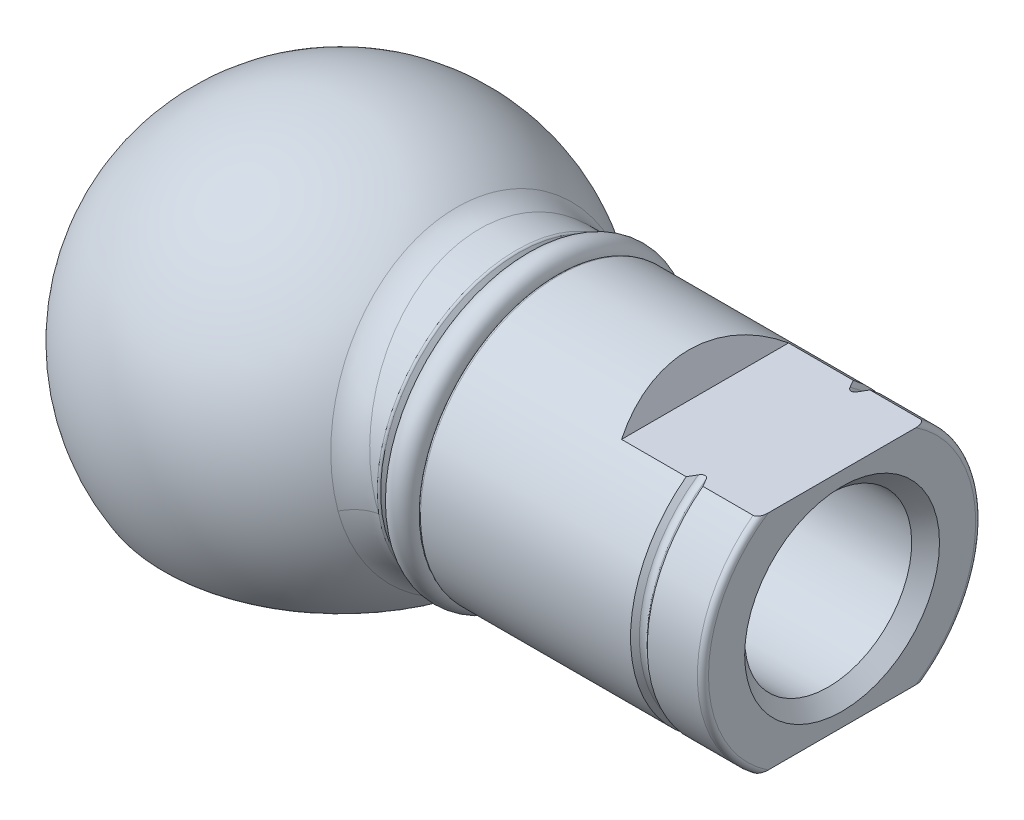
SolidWorks part; units mm, degrees
ref_plane "Plan de face" through (0, 0, 0) normal (0, 0, 1) x (1, 0, 0)
ref_plane "Plan de dessus" through (0, 0, 0) normal (0, 1, 0) x (1, 0, 0)
ref_plane "Plan de droite" through (0, 0, 0) normal (1, 0, 0) x (0, 0, -1)
sketch "Esquisse1" plane through (0, 0, 0) normal (0, 0, 1) x (1, 0, 0)
  line L0 (0, 0) -> (1.5011, 2.6)
  line L1 (1.5011, 2.6) -> (3.5011, 2.6)
  line L2 (3.5011, 2.6) -> (3.9011, 3)
  line L3 (3.9011, 3) -> (11.4011, 3)
  line L4 (11.9011, 3.5) -> (11.9011, 4.8)
  line L5 (11.7011, 5) -> (9.9011, 5)
  line L6 (1.6655, 4.95) -> (1.4346, 4.55)
  line L7 (0.592, 4.5132) -> (0.281, 4.9574)
  line L8 (0.1991, 5) -> (-1.5989, 5)
  line L9 (-6.0989, 6.5) -> (-6.0989, -1) construction
  line L10 (-6.0989, 0) -> (-1.0989, 0) construction
  line L11 (11.4011, 3) -> (11.9011, 3.5)
  line L12 (-1.0989, 0) -> (0, 0)
  line L13 (-1.5989, 5) -> (-1.5989, 2.1794)
  line L14 (9.9011, 5) -> (9.7425, 4.8414)
  line L15 (9.4597, 4.8414) -> (9.3011, 5)
  line L16 (9.3011, 5) -> (1.7521, 5)
  circle A0 centre (-6.0989, -1) radius 7.5 construction
  arc A1 (1.4346, 4.55) -> (0.592, 4.5132) centre (1.0015, 4.8) cw
  arc A2 (-1.0989, 0) -> (-1.5989, 2.1794) centre (-6.0989, 0) ccw
  arc A3 (1.7521, 5) -> (1.6655, 4.95) centre (1.7521, 4.9) ccw
  arc A4 (0.281, 4.9574) -> (0.1991, 5) centre (0.1991, 4.9) ccw
  arc A5 (11.9011, 4.8) -> (11.7011, 5) centre (11.7011, 4.8) ccw
  arc A6 (9.7425, 4.8414) -> (9.4597, 4.8414) centre (9.6011, 4.9828) cw
  point P5 (11.9011, 3)
  point P23 (0.2511, 5)
  point P33 (9.6011, 4.7)
  dimension "D2" = 15
  dimension "D10" = 0.5
  dimension "D17" = 10
  dimension "D18" = 0.1
  dimension "D19" = 0.2
  dimension "D24" = 0.2
  dimension "D1" = 6.5
  dimension "D3" = 120
  dimension "D4" = 45
  dimension "D5" = 0.4
  dimension "D6" = 3
  dimension "D7" = 5
  dimension "D8" = 8
  dimension "D9" = 2
  dimension "D11" = 120
  dimension "D12" = 35
  dimension "D13" = 0.2
  dimension "D14" = 30
  dimension "D15" = 18
  dimension "D16" = 1.85
  dimension "D20" = 0.3
  dimension "D21" = 45
  dimension "D23" = 2.3
revolve "Révolution1" add sketch "Esquisse1" angle 360 about L10
sketch "Esquisse2" plane through (0, 0, 0) normal (0, 0, 1) x (1, 0, 0)
  line L0 (-6.0989, 6.5) -> (-6.0989, -1) construction
  line L1 (-1.0989, 0) -> (-1.0989, -1.3)
  line L2 (-0.4989, -5) -> (0.19, -5)
  line L3 (-1.0989, -1.3) -> (-0.0989, -1.3)
  line L4 (-0.0989, -1.3) -> (-0.0989, -2.3)
  line L5 (-0.0989, -2.3) -> (-0.5989, -2.3)
  line L6 (-0.5989, -2.3) -> (-0.5989, -4.9)
  line L7 (-6.0989, 5) -> (-6.0989, 6.5)
  circle A0 centre (-6.0989, -1) radius 7.5 construction
  arc A1 (0.275, -4.9527) -> (-6.0989, 6.5) centre (-6.0989, -1) ccw
  arc A2 (-1.0989, 0) -> (-1.5989, 2.1794) centre (-6.0989, 0) ccw construction
  arc A3 (-1.0989, 0) -> (-6.0989, 5) centre (-6.0989, 0) ccw
  arc A4 (0.19, -5) -> (0.275, -4.9527) centre (0.19, -4.9) ccw
  arc A5 (-0.5989, -4.9) -> (-0.4989, -5) centre (-0.4989, -4.9) ccw
  dimension "D5" = 0.1
  dimension "D1" = 5.5
  dimension "D2" = 1
  dimension "D3" = 1.3
  dimension "D4" = 0.5
revolve "Révolution2" add sketch "Esquisse2" angle 360 about L0
fillet "Congé1" radius 1.5 7 edges at (0.2467, -4.9728, -0.3883) (0.2346, -4.9866, 0.262) (0.2417, -4.9288, 0.782) (-1.5947, 4.9812, 0.433)
sketch "Esquisse4" plane through (0, 0, 0) normal (0, 0, 1) x (1, 0, 0)
  line L0 (-0.4989, -5) -> (0.19, -5) construction
  line L2 (-1.0989, 0) -> (-1.0989, -1.3) construction
  line L3 (-1.0989, -1.3) -> (-0.0989, -1.3) construction
  line L4 (-0.0989, -1.3) -> (-0.0989, -2.3) construction
  line L5 (-0.0989, -2.3) -> (-0.5989, -2.3) construction
  line L6 (-0.5989, -2.3) -> (-0.5989, -4.9) construction
  line L7 (-0.4989, -5) -> (0.19, -5)
  line L8 (0.19, -5) -> (0.19, -6.1991)
  line L9 (-1.0989, 0) -> (-1.0989, -1.3)
  line L10 (-1.0989, -1.3) -> (-0.0989, -1.3)
  line L11 (-0.0989, -1.3) -> (-0.0989, -2.3)
  line L12 (-0.0989, -2.3) -> (-0.5989, -2.3)
  line L13 (-0.5989, -2.3) -> (-0.5989, -4.9)
  line L14 (0.19, -6.1991) -> (-6.0989, -6.1991)
  line L15 (-6.0989, -6.1991) -> (-6.0989, 5)
  arc A2 (-1.0989, 0) -> (-6.0989, 5) centre (-6.0989, 0) ccw construction
  arc A3 (-0.5989, -4.9) -> (-0.4989, -5) centre (-0.4989, -4.9) ccw construction
  arc A6 (-1.0989, 0) -> (-6.0989, 5) centre (-6.0989, 0) ccw
  arc A7 (-0.5989, -4.9) -> (-0.4989, -5) centre (-0.4989, -4.9) ccw
revolve "Enlèvement de matière-Révolution1" cut sketch "Esquisse4" angle 360 about L15
sketch "Esquisse8" plane through (11.9011, 0, 0) normal (1, 0, 0) x (0, 0, -1)
  line L1 (-11.2801, -4) -> (12.1843, -4)
  line L2 (-11.2801, -4) -> (-11.2801, -10.7364)
  line L3 (-11.2801, -10.7364) -> (12.1843, -10.7364)
  line L4 (12.1843, -4) -> (12.1843, -10.7364)
  line L13 (-8.8839, 7.21) -> (7.392, 7.21)
  line L14 (-8.8839, 7.21) -> (-8.8839, 4)
  line L15 (-8.8839, 4) -> (7.392, 4)
  line L16 (7.392, 7.21) -> (7.392, 4)
  dimension "D2" = 8
extrude "Enlèv. mat.-Extru.3" cut sketch "Esquisse8" against normal blind 5.5
chamfer "Chanfrein1" distance 1 angle 30 2 edges at (6.4011, 4, 0) (6.4011, -4, 0)
sketch "Esquisse9" plane through (0, 0, 0) normal (0, 0, 1) x (1, 0, 0)
  circle A0 centre (1.0015, 4.8) radius 0.5
revolve "Révolution4" add sketch "Esquisse9" angle 360 about L12
